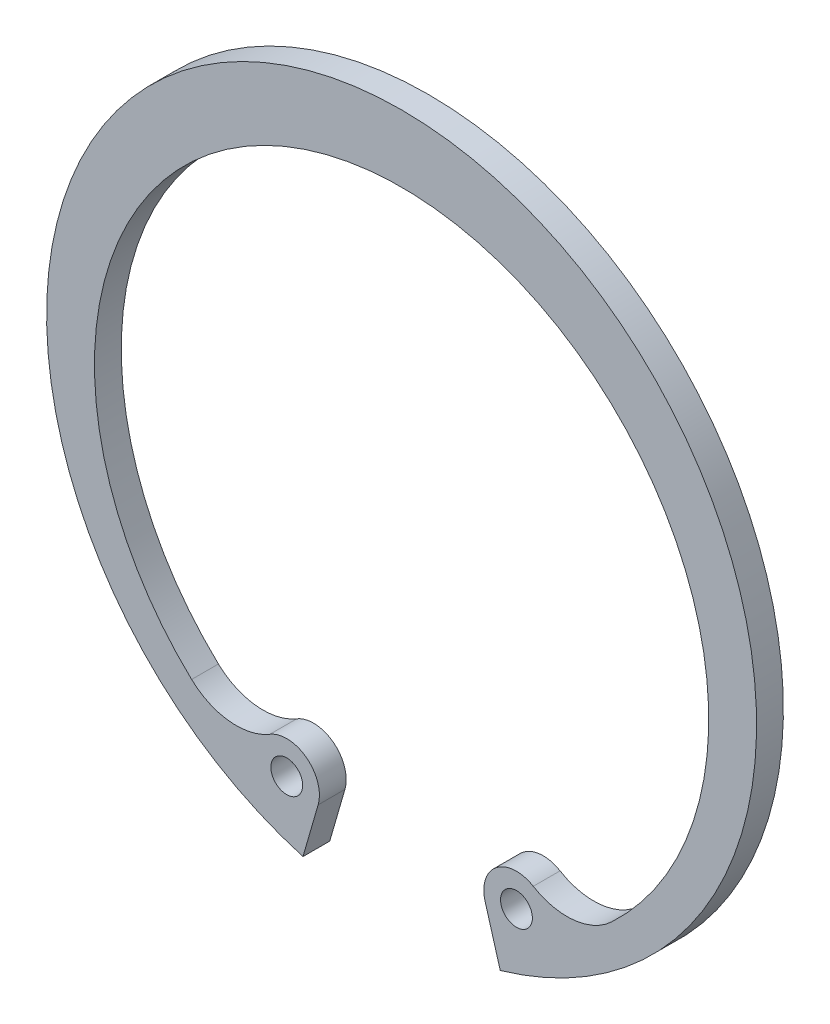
SolidWorks part; units mm, degrees
ref_plane "Plane1" through (0, 0, 0) normal (0, 0, 1) x (1, 0, 0)
ref_plane "Plane2" through (0, 0, 0) normal (0, 1, 0) x (1, 0, 0)
ref_plane "Plane3" through (0, 0, 0) normal (1, 0, 0) x (0, 0, -1)
sketch "Clipboard" plane through (0, 0, 0) normal (0, 0, 1) x (1, 0, 0)
  line L0 (0, 0) -> (4, 0)
  line L1 (0, 0) -> (0, 2)
  line L2 (0, 0) -> (0, -5.1)
  circle A0 centre (0, 0) radius 0.95
  circle A1 centre (0, 0) radius 20
  dimension "HoleDia" = 1.9
  dimension "BoreDia" = 40
  dimension "LargeSection" = 4
  dimension "SmallSection" = 2
  dimension "LugSection" = 5.1
sketch "BodySke" plane through (0, 0, 0) normal (0, 0, 1) x (1, 0, 0)
  line L0 (-1.5431, 0) -> (1.5431, 0) construction
  line L1 (0, 0) -> (0, 17.2) construction
  line L2 (5.8905, -20.3652) -> (4.9859, -17.2378)
  line L3 (-5.8905, -20.3652) -> (-4.9859, -17.2378)
  line L4 (0, 0) -> (13.6846, -16.1917) construction
  line L5 (0, 0) -> (-13.6846, -16.1917) construction
  line L6 (-6.5951, -15.7834) -> (-7.1231, -17.6086) construction
  line L7 (6.6505, -15.9749) -> (7.0677, -17.417) construction
  arc A0 (-4.9859, -17.2378) -> (-7.8639, -15.0248) centre (-6.8591, -16.696) ccw
  arc A1 (7.8639, -15.0248) -> (4.9859, -17.2378) centre (6.8591, -16.696) ccw
  arc A2 (12.3936, -14.6642) -> (-12.3936, -14.6642) centre (0, -1.1423) ccw construction
  arc A3 (5.8905, -20.3652) -> (-5.8905, -20.3652) centre (0, 0) ccw
  circle A4 centre (6.8591, -16.696) radius 0.95
  circle A5 centre (-6.8591, -16.696) radius 0.95
  arc A7 (12.5398, -14.5287) -> (-12.5398, -14.5287) centre (0, -1.1423) ccw
  arc A8 (-6.8591, -16.696) -> (6.8591, -16.696) centre (0, 0) ccw construction
  arc A9 (-12.5398, -14.5287) -> (-7.8639, -15.0248) centre (-9.8736, -11.6824) ccw
  arc A10 (7.8639, -15.0248) -> (12.5398, -14.5287) centre (9.8736, -11.6824) ccw
  dimension "GrooveDia" = 42.4
  dimension "TipRad" = 1.95
  dimension "HoleOffsetRad" = 18.05
  dimension "HoleDia" = 1.9
  dimension "FilletRad" = 3.9
  dimension "LargeRad" = 17.2
  dimension "SmallRad" = 19.2
  dimension "SmallAngle" = 80.407
  dimension "GapAngle" = 32.264
extrude "Body" add sketch "BodySke" against normal blind 1.6
sketch "ModLugSke" plane through (0, 0, 0) normal (0, 0, 1) x (1, 0, 0)
  line L0 (5.8905, -20.3652) -> (4.73, -16.3532)
  line L1 (-5.8905, -20.3652) -> (-4.73, -16.3532)
  line L2 (10.4992, -12.2056) -> (13.825, -16.072) construction
  line L3 (-10.4992, -12.2056) -> (-13.825, -16.072) construction
  line L4 (-5.8905, -20.3652) -> (-4.9859, -17.2378) construction
  line L5 (4.9859, -17.2378) -> (5.8905, -20.3652) construction
  line L6 (0, 0) -> (0, -12.7358) construction
  line L7 (12.5143, -14.5483) -> (13.825, -16.072)
  line L8 (-13.825, -16.072) -> (-12.5143, -14.5483)
  arc A0 (5.8905, -20.3652) -> (13.825, -16.072) centre (0, 0) ccw
  arc A1 (-7.3317, -14.3337) -> (-5.3282, -15.1928) centre (0, 0) ccw
  arc A2 (5.8905, -20.3652) -> (-5.8905, -20.3652) centre (0, 0) ccw construction
  arc A3 (7.8639, -15.0248) -> (4.9859, -17.2378) centre (6.8591, -16.696) ccw construction
  arc A4 (-7.3317, -14.3337) -> (-8.4074, -14.4802) centre (-7.7644, -15.1795) ccw
  arc A5 (-12.5143, -14.5483) -> (-8.4074, -14.4802) centre (-10.4992, -12.2056) ccw
  arc A6 (12.5398, -14.5287) -> (-12.5398, -14.5287) centre (0, -1.1423) ccw construction
  arc A7 (8.4074, -14.4802) -> (12.5143, -14.5483) centre (10.4992, -12.2056) ccw
  arc A8 (5.3282, -15.1928) -> (7.3317, -14.3337) centre (0, 0) ccw
  arc A9 (-13.825, -16.072) -> (-5.8905, -20.3652) centre (0, 0) ccw
  circle A10 centre (-6.8591, -16.696) radius 0.95
  circle A11 centre (-6.8591, -16.696) radius 0.95 construction
  circle A12 centre (6.8591, -16.696) radius 0.95
  circle A13 centre (6.8591, -16.696) radius 0.95 construction
  arc A14 (-5.3282, -15.1928) -> (-4.73, -16.3532) centre (-5.6426, -16.0892) cw
  arc A15 (5.3282, -15.1928) -> (4.73, -16.3532) centre (5.6426, -16.0892) ccw
  arc A16 (7.3317, -14.3337) -> (8.4074, -14.4802) centre (7.7644, -15.1795) cw
  point P43 (4.4734, -15.466)
  dimension "LugAng" = 54.18
extrude "ModLug" [suppressed] add sketch "ModLugSke" against normal through all
equation "' \"BoreDia@Clipboard\" = 8"
equation "' \"Thickness@Body\" = 0.4"
equation "' \"GrooveDia@BodySke\" = 8.4"
equation "' \"LugSection@Clipboard\" = 1.7"
equation "' \"LargeSection@Clipboard\" = 0.85"
equation "' \"SmallSection@Clipboard\" = 0.45"
equation "' \"HoleDia@Clipboard\" = 0.8"
equation "' \"BoreDia@Clipboard\" = 25"
equation "' \"Thickness@Body\" = 1.1"
equation "' \"GrooveDia@BodySke\" = 26.6"
equation "' \"LugSection@Clipboard\" = 4"
equation "' \"LargeSection@Clipboard\" = 2.6"
equation "' \"SmallSection@Clipboard\" = 1.3"
equation "' \"HoleDia@Clipboard\" = 1.5"
equation "\"TipRad@BodySke\" = (\"LugSection@Clipboard\" - (\"GrooveDia@BodySke\" / 2  -  \"BoreDia@Clipboard\" / 2 ) ) / 2"
equation "\"HoleOffsetRad@BodySke\" = (\"GrooveDia@BodySke\" / 2) - \"LugSection@Clipboard\"  + \"TipRad@BodySke\""
equation "\"LargeRad@BodySke\" =  \"GrooveDia@BodySke\" / 2 -  \"LargeSection@Clipboard\""
equation "\"SmallRad@BodySke\" =  \"GrooveDia@BodySke\" / 2 -  \"SmallSection@Clipboard\""
equation "\"HoleDia@BodySke\" =  \"HoleDia@Clipboard\""
equation "\"FilletRad@BodySke\" = \"TipRad@BodySke\" * 2"
equation "\"GapAngle@BodySke\" = 360 - 0.965 * 360 * ( \"BoreDia@Clipboard\" /  \"GrooveDia@BodySke\")"
equation "\"LugAng@ModLugSke\" = \"GapAngle@BodySke\"  + 1.5 * 360 * (\"LugSection@Clipboard\" / (\"BoreDia@Clipboard\" * 3.1416))"
